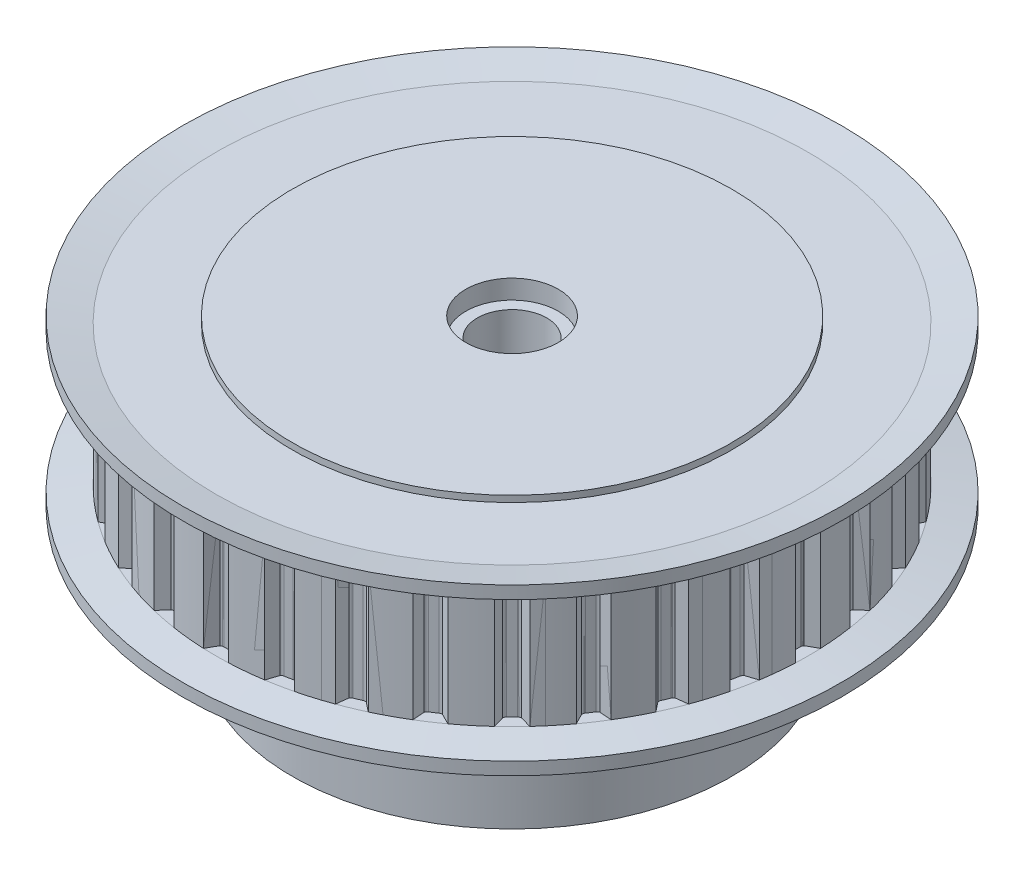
SolidWorks part; units mm, degrees
ref_plane "Face" through (0, 0, 0) normal (0, 0, 1) x (1, 0, 0)
ref_plane "Dessus" through (0, 0, 0) normal (0, 1, 0) x (1, 0, 0)
ref_plane "Droite" through (0, 0, 0) normal (1, 0, 0) x (0, 0, -1)
imported_body "Importée1"
sketch "Esquisse1" plane through (0, 25, 0) normal (0, 1, 0) x (-1, 0, 0)
  circle A0 centre (0, 0) radius 28.5
  circle A1 centre (0, 0) radius 28.5 construction
extrude "Enlèv. mat.-Extru.1" cut sketch "Esquisse1" against normal up to surface (1.65 mm away)
sketch "Esquisse2" plane through (0, 0, 0) normal (0, -1, 0) x (1, 0, 0)
  circle A0 centre (0, 0) radius 19
  circle A1 centre (0, 0) radius 28.5
  circle A2 centre (0, 0) radius 28.5 construction
  circle A3 centre (0, 0) radius 19 construction
extrude "Enlèv. mat.-Extru.2" cut sketch "Esquisse2" against normal up to surface (12.35 mm away)
ref_plane "Plan1" through (0, 17.85, 0) normal (0, 1, 0) x (-1, 0, 0)
sketch "Esquisse3" plane through (0, 23.35, 0) normal (0, 1, 0) x (-1, 0, 0)
  circle A0 centre (0, 0) radius 3
  circle A1 centre (0, 0) radius 4 construction
  circle A2 centre (0, 0) radius 4
  dimension "D1" = 6
extrude "Boss.-Extru.3" add sketch "Esquisse3" against normal through all
sketch "Esquisse4" plane through (0, 0, 0) normal (0, -1, 0) x (1, 0, 0)
  circle A1 centre (0, 0) radius 12.5
  circle A3 centre (0, 0) radius 19 construction
  dimension "D1" = 25
extrude "Enlèv. mat.-Extru.3" cut sketch "Esquisse4" against normal up to surface (12.35 mm away) flip side to cut
sketch "Esquisse5" plane through (0, 0, 0) normal (0, -1, 0) x (1, 0, 0)
  circle A0 centre (0, 0) radius 8
  circle A1 centre (0, 0) radius 12.5 construction
  dimension "D1" = 16
extrude "Enlèv. mat.-Extru.4" cut sketch "Esquisse5" against normal up to surface (12.35 mm away) flip side to cut
